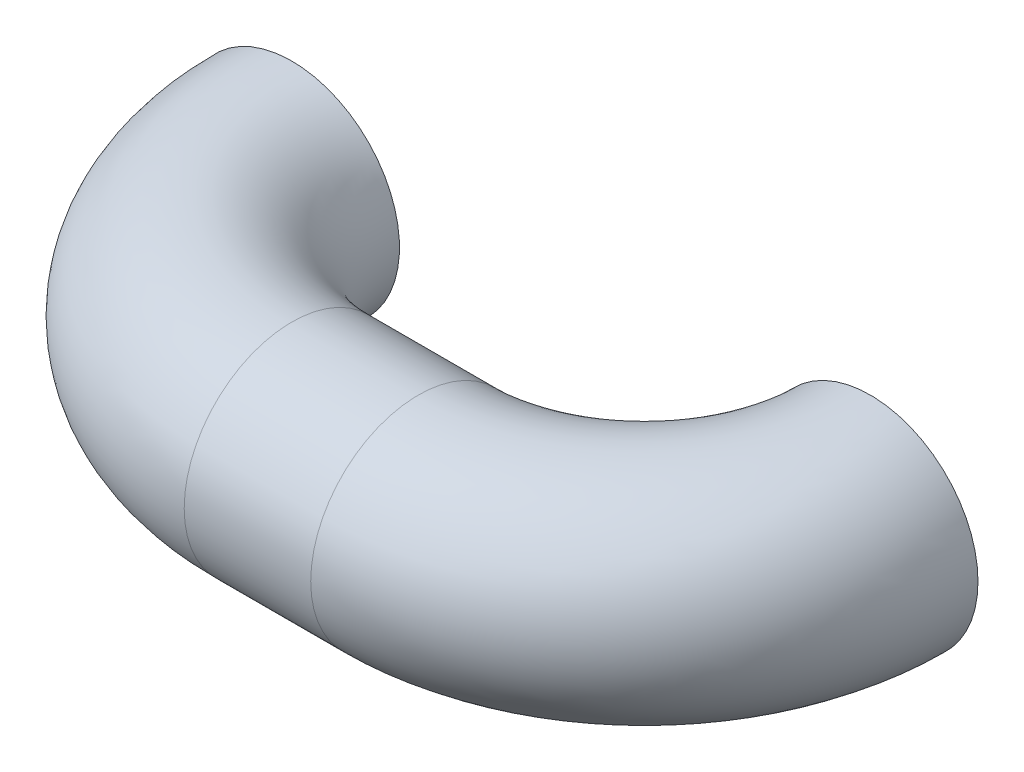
SolidWorks part; units mm, degrees
ref_plane "Alzado" through (0, 0, 0) normal (0, 0, 1) x (1, 0, 0)
ref_plane "Planta" through (0, 0, 0) normal (0, 1, 0) x (1, 0, 0)
ref_plane "Vista lateral" through (0, 0, 0) normal (1, 0, 0) x (0, 0, -1)
sketch "Croquis1" plane through (0, 0, 0) normal (0, 0, 1) x (1, 0, 0)
  line L1 (-10, 0) -> (-10, 10.2539) construction
  circle A0 centre (0, 0) radius 4.7625
  circle A1 centre (0, 0) radius 3.8625
  dimension "D1" = 9.525
  dimension "D2" = 7.725
sketch "Croquis4" plane through (0, 0, 0) normal (0, 0, 1) x (1, 0, 0)
  line L0 (-10, -6.8377) -> (-10, 7.0303) construction
  circle A0 centre (0, 0) radius 3.8625
  circle A1 centre (0, 0) radius 4.7625
  dimension "D1" = 7.725
  dimension "D2" = 9.525
  dimension "D3" = 10
revolve "Revolución5" add sketch "Croquis1" angle 90 about L1
sketch "Croquis7" plane through (-10, 0, 0) normal (-1, 0, 0) x (0, 0, 1)
  circle A0 centre (10, 0) radius 3.8625 construction
  circle A1 centre (10, 0) radius 4.7625 construction
  circle A2 centre (10, 0) radius 3.8625
  circle A3 centre (10, 0) radius 4.7625
extrude "Saliente-Extruir3" add sketch "Croquis7" along normal blind 5.5976
sketch "Croquis8" plane through (-15.5976, 0, 0) normal (-1, 0, 0) x (0, 0, 1)
  line L0 (0, 7.0303) -> (0, -7.3344) construction
  line L1 (0, -6.8377) -> (0, 7.0303) construction
  circle A0 centre (10, 0) radius 3.8625 construction
  circle A1 centre (10, 0) radius 4.7625 construction
  circle A2 centre (10, 0) radius 3.8625
  circle A3 centre (10, 0) radius 4.7625
revolve "Revolución6" add sketch "Croquis8" angle 90 about L0
